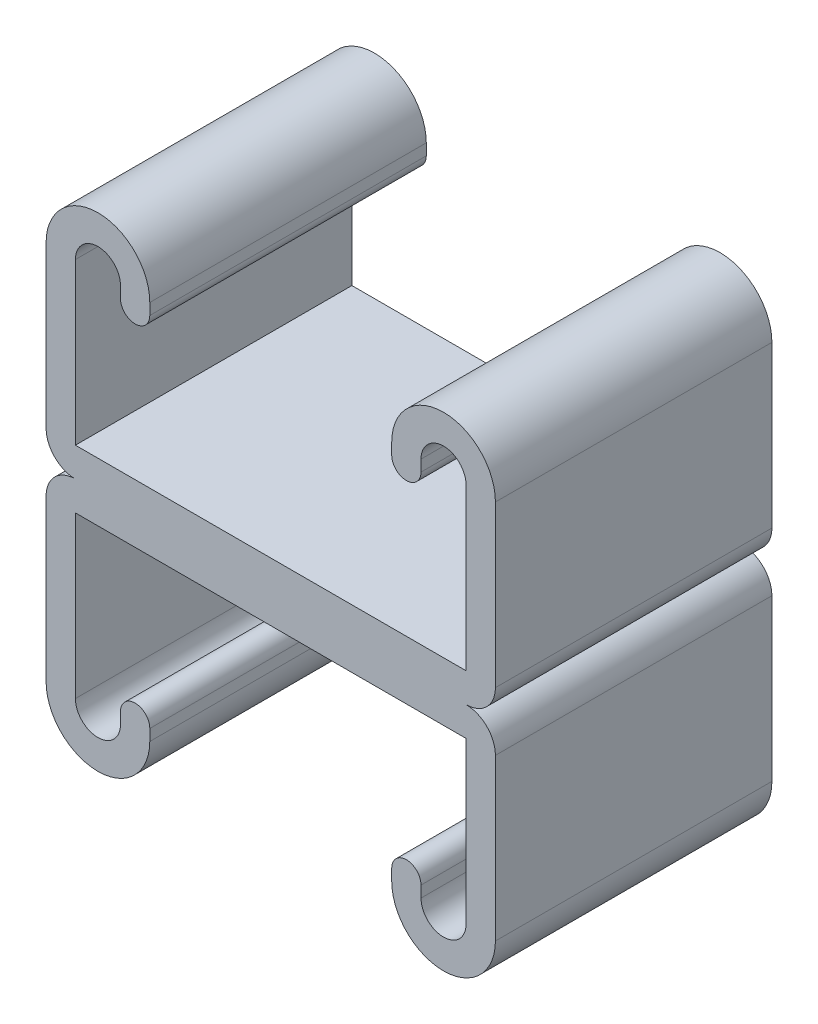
SolidWorks part; units mm, degrees
ref_plane "Plane1" through (0, 0, 0) normal (0, 0, 1) x (1, 0, 0)
ref_plane "Plane2" through (0, 0, 0) normal (0, 1, 0) x (1, 0, 0)
ref_plane "Plane3" through (0, 0, 0) normal (1, 0, 0) x (0, 0, -1)
sketch "Sketch1" plane through (0, 0, 0) normal (0, 0, 1) x (1, 0, 0)
  line L0 (-20.6375, 17.4625) -> (-20.6375, 2.6924)
  line L1 (-17.9451, 0) -> (17.9451, 0)
  line L2 (20.6375, 2.6924) -> (20.6375, 17.4625)
  line L3 (11.1125, 17.4625) -> (11.1125, 16.4274)
  line L4 (-11.1125, 17.4625) -> (-11.1125, 16.4274)
  line L5 (-13.8049, 17.4625) -> (-13.8049, 16.4274)
  line L6 (-17.9451, 17.4625) -> (-17.9451, 2.6924)
  line L7 (-17.9451, 2.6924) -> (17.9451, 2.6924)
  line L8 (17.9451, 2.6924) -> (17.9451, 17.4625)
  line L9 (13.8049, 17.4625) -> (13.8049, 16.4274)
  line L10 (-25.4, 22.225) -> (25.4, 22.225) construction
  line L11 (-12.8524, 15.0812) -> (12.8524, 15.0812) construction
  arc A0 (20.6375, 17.4625) -> (11.1125, 17.4625) centre (15.875, 17.4625) ccw
  arc A1 (-20.6375, 17.4625) -> (-11.1125, 17.4625) centre (-15.875, 17.4625) cw
  arc A2 (-17.9451, 0) -> (-20.6375, 2.6924) centre (-17.9451, 2.6924) cw
  arc A3 (17.9451, 0) -> (20.6375, 2.6924) centre (17.9451, 2.6924) ccw
  arc A4 (-17.9451, 17.4625) -> (-13.8049, 17.4625) centre (-15.875, 17.4625) cw
  arc A5 (17.9451, 17.4625) -> (13.8049, 17.4625) centre (15.875, 17.4625) ccw
  arc A6 (11.1125, 16.4274) -> (13.8049, 16.4274) centre (12.4587, 16.4274) ccw
  arc A7 (-11.1125, 16.4274) -> (-13.8049, 16.4274) centre (-12.4587, 16.4274) cw
  dimension "D1" = 2.6924
  dimension "Width" = 41.275
  dimension "D6" = 9.525
  dimension "D7" = 22.225
  dimension "D9" = 7.1437
  dimension "D2" = 22.225
  dimension "gauge" = 2.6924
extrude "Base-Extrude" add sketch "Sketch1" along normal mid plane 25.4
mirror "Mirror1" about plane through (0, 0, 0) normal (0, 1, 0) of "Base-Extrude"
equation "\"D7@Sketch1\" = \"Width@Sketch1\" - 2 * \"D6@Sketch1\""
equation "\"D1@Sketch1\" = \"gauge@Sketch1\""
